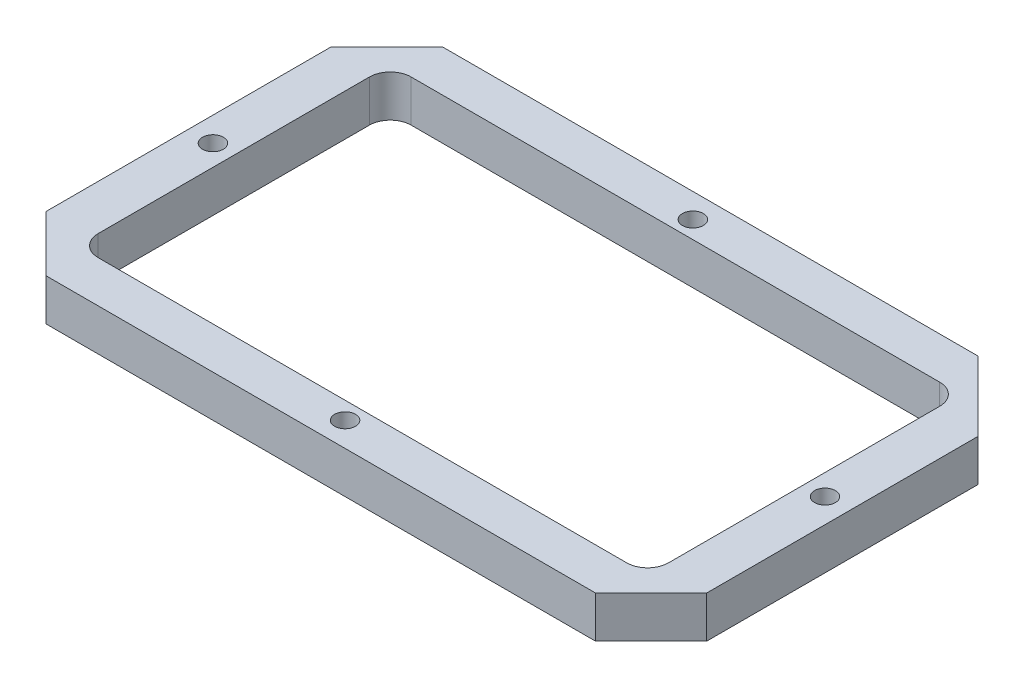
SolidWorks part; units mm, degrees
ref_plane "Ebene vorne" through (0, 0, 0) normal (0, 0, 1) x (1, 0, 0)
ref_plane "Ebene oben" through (0, 0, 0) normal (0, 1, 0) x (1, 0, 0)
ref_plane "Ebene rechts" through (0, 0, 0) normal (1, 0, 0) x (0, 0, -1)
sketch "Skizze1" plane through (0, 0, 0) normal (0, 1, 0) x (1, 0, 0)
  line L0 (-97.6104, 0) -> (96.3111, 0) construction
  line L1 (0, 57.3319) -> (0, -62.2043) construction
  line L2 (37.5, 28.5) -> (47.5, 18.5)
  line L3 (-39.5, 28.5) -> (37.5, 28.5)
  line L4 (-47.5, 20.5) -> (-47.5, -20.5)
  line L5 (-39.5, -28.5) -> (39.5, -28.5)
  line L6 (47.5, 18.5) -> (47.5, -20.5)
  line L7 (39.5, -28.5) -> (47.5, -20.5)
  line L8 (-47.5, -20.5) -> (-39.5, -28.5)
  line L9 (-47.5, 20.5) -> (-39.5, 28.5)
  line L11 (-38, 22.5) -> (38, 22.5)
  line L12 (-41, 19.5) -> (-41, -19.5)
  line L13 (-38, -22.5) -> (38, -22.5)
  line L14 (41, 19.5) -> (41, -19.5)
  arc A0 (-38, 22.5) -> (-41, 19.5) centre (-38, 19.5) ccw
  arc A1 (-41, -19.5) -> (-38, -22.5) centre (-38, -19.5) ccw
  arc A2 (38, -22.5) -> (41, -19.5) centre (38, -19.5) ccw
  arc A3 (38, 22.5) -> (41, 19.5) centre (38, 19.5) cw
  circle A4 centre (0, 25) radius 1.5
  circle A5 centre (0, -25) radius 1.5
  circle A6 centre (-44, 0) radius 1.5
  circle A7 centre (44, 0) radius 1.5
  point P5 (-47.5, 28.5)
  point P6 (47.5, -28.5)
  point P7 (-47.5, -28.5)
  point P8 (47.5, 28.5)
  point P23 (-41, 22.5)
  point P28 (41, -22.5)
  point P31 (41, 22.5)
  dimension "D9" = 3
  dimension "D10" = 3
  dimension "D12" = 3
  dimension "D1" = 95
  dimension "D2" = 57
  dimension "D3" = 82
  dimension "D4" = 45
  dimension "D11" = 3.5
  dimension "D13" = 3.5
extrude "Aufsatz-Linear austragen1" add sketch "Skizze1" along normal blind 6
sketch "Skizze2" plane through (33, 0, -33) normal (0.7071, 0, -0.7071) x (-0.7071, 0, -0.7071)
  line L0 (-20.5061, 3) -> (-6.364, 3) construction
  line L1 (-20.5061, 6) -> (-20.5061, 0) construction
  line L2 (-6.364, 6) -> (-6.364, 0) construction
  circle A0 centre (-13.435, 3) radius 1
  dimension "D1" = 2
extrude "Schnitt-Linear austragen1" cut sketch "Skizze2" against normal up to next
